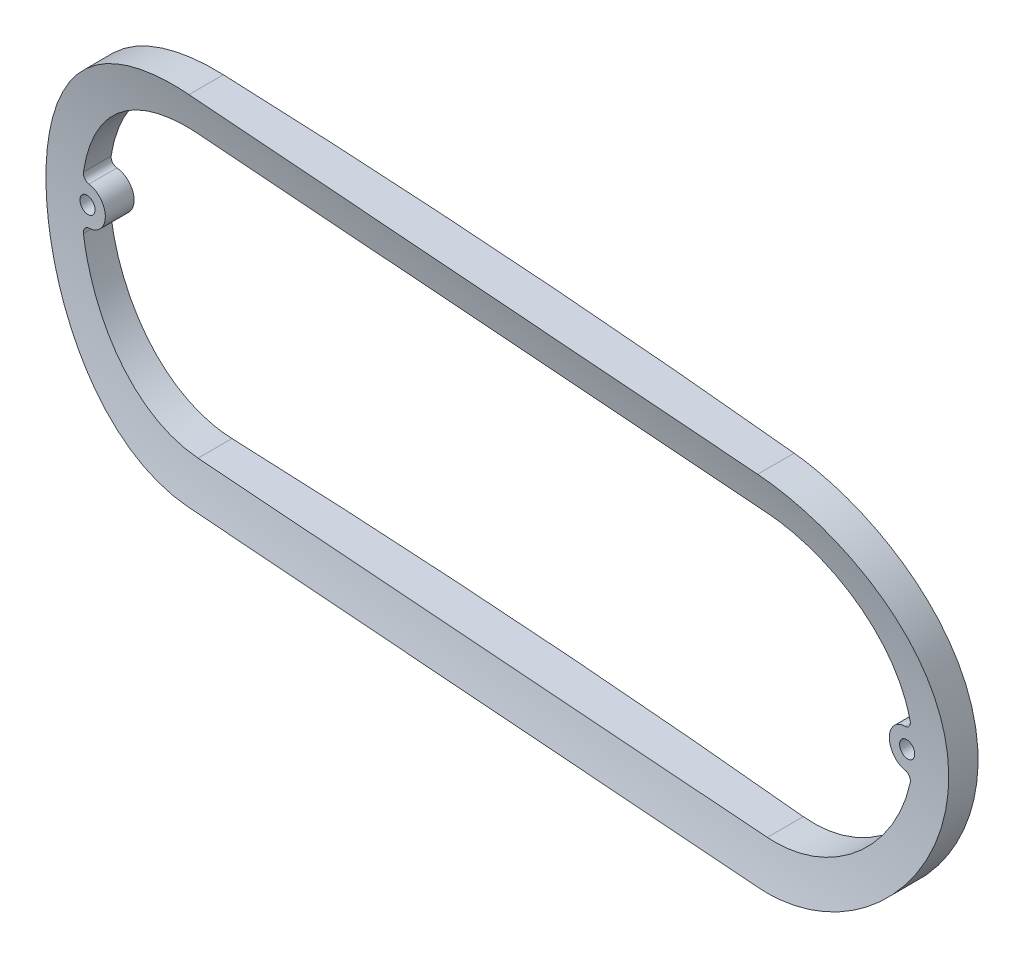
SolidWorks part; units mm, degrees
ref_plane "Front Plane" through (0, 0, 0) normal (0, 0, 1) x (1, 0, 0)
ref_plane "Top Plane" through (0, 0, 0) normal (0, 1, 0) x (1, 0, 0)
ref_plane "Right Plane" through (0, 0, 0) normal (1, 0, 0) x (0, 0, -1)
sketch "Sketch1" plane through (0, 0, 0) normal (0, 0, 1) x (1, 0, 0)
  line L0 (292.1, -38.1) -> (139.7, -38.1) construction
  line L1 (292.1, -38.1) -> (139.7, -38.1) construction
  line L2 (139.7, 38.1) -> (292.1, 38.1) construction
  line L3 (139.7, 38.1) -> (292.1, 38.1) construction
  line L4 (292.1, -44.45) -> (139.7, -44.45)
  line L5 (139.7, 44.45) -> (292.1, 44.45)
  line L6 (139.7, 34.925) -> (292.1, 34.925)
  line L7 (292.1, -34.925) -> (139.7, -34.925)
  arc A0 (139.7, 38.1) -> (139.7, -38.1) centre (139.7, 0) ccw construction
  arc A1 (139.7, 38.1) -> (139.7, -38.1) centre (139.7, 0) ccw construction
  arc A2 (292.1, -38.1) -> (292.1, 38.1) centre (292.1, 0) ccw construction
  arc A3 (292.1, -38.1) -> (292.1, 38.1) centre (292.1, 0) ccw construction
  arc A4 (139.7, 44.45) -> (139.7, -44.45) centre (139.7, 0) ccw
  arc A5 (292.1, -44.45) -> (292.1, 44.45) centre (292.1, 0) ccw
  arc A6 (292.1, -34.925) -> (326.7226, -4.5858) centre (292.1, 0) ccw
  arc A7 (139.7, 34.925) -> (105.0774, 4.5858) centre (139.7, 0) ccw
  circle A10 centre (106.3625, 0) radius 2.0193
  arc A11 (105.0774, -4.5858) -> (105.0774, 4.5858) centre (106.3625, 0) ccw
  arc A12 (326.7226, 4.5858) -> (326.7226, -4.5858) centre (325.4375, 0) ccw
  arc A13 (105.0774, -4.5858) -> (139.7, -34.925) centre (139.7, 0) ccw
  arc A14 (139.7, 34.925) -> (139.7, -34.925) centre (139.7, 0) ccw construction
  circle A15 centre (325.4375, 0) radius 2.0193
  arc A16 (326.7226, 4.5858) -> (292.1, 34.925) centre (292.1, 0) ccw
  arc A18 (292.1, -34.925) -> (292.1, 34.925) centre (292.1, 0) ccw construction
  dimension "D3" = 4.0386
  dimension "D5" = 9.525
  dimension "D7" = 9.525
  dimension "D8" = 4.0386
  dimension "D4" = 33.3375
  dimension "D6" = 33.3375
  dimension "D9" = 219.075
  dimension "D1" = 6.35
  dimension "D2" = 3.175
extrude "Boss-Extrude1" add sketch "Sketch1" against normal up to surface (176.7993 mm away)
fillet "Fillet1" radius 1.5875 4 edges at (326.7226, 4.5858, -84.2738) (326.7226, -4.5858, -84.2738) (105.0774, -4.5858, -91.634) (105.0774, 4.5858, -91.634)
sketch "Sketch3" plane through (0, 0, 0) normal (0, 1, 0) x (-1, 0, 0)
  line L1 (-81.9355, 20.0601) -> (-350.4565, 20.0601)
  line L2 (-81.9355, 20.0601) -> (-81.9355, -86.776)
  line L3 (-81.9355, -86.776) -> (-350.4565, -86.776)
  line L4 (-350.4565, 20.0601) -> (-350.4565, -86.776)
extrude "Cut-Extrude3" cut sketch "Sketch3" against normal through all and the other way through all
sketch "Sketch2" plane through (0, 0, 0) normal (0, 1, 0) x (-1, 0, 0)
  line L0 (-85.725, -57.5421) -> (-85.725, -177.8)
  line L1 (-85.725, -177.8) -> (-362.9708, -158.4131)
  line L2 (-362.9708, -158.4131) -> (-362.9708, -57.5421)
  line L3 (-362.9708, -57.5421) -> (-85.725, -57.5421)
  line L4 (0, 0) -> (-63.5426, 0) construction
  dimension "D1" = 177.8
  dimension "D2" = 4
  dimension "D3" = 85.725
revolve "Cut-Revolve2" cut sketch "Sketch2" angle 360 about L4
equation "\"Buoyancy\"=\"SW-Volume\"*(\"SW-Density\"-.037062)"
equation "\"Air Weight\"= \"SW-Mass\""
